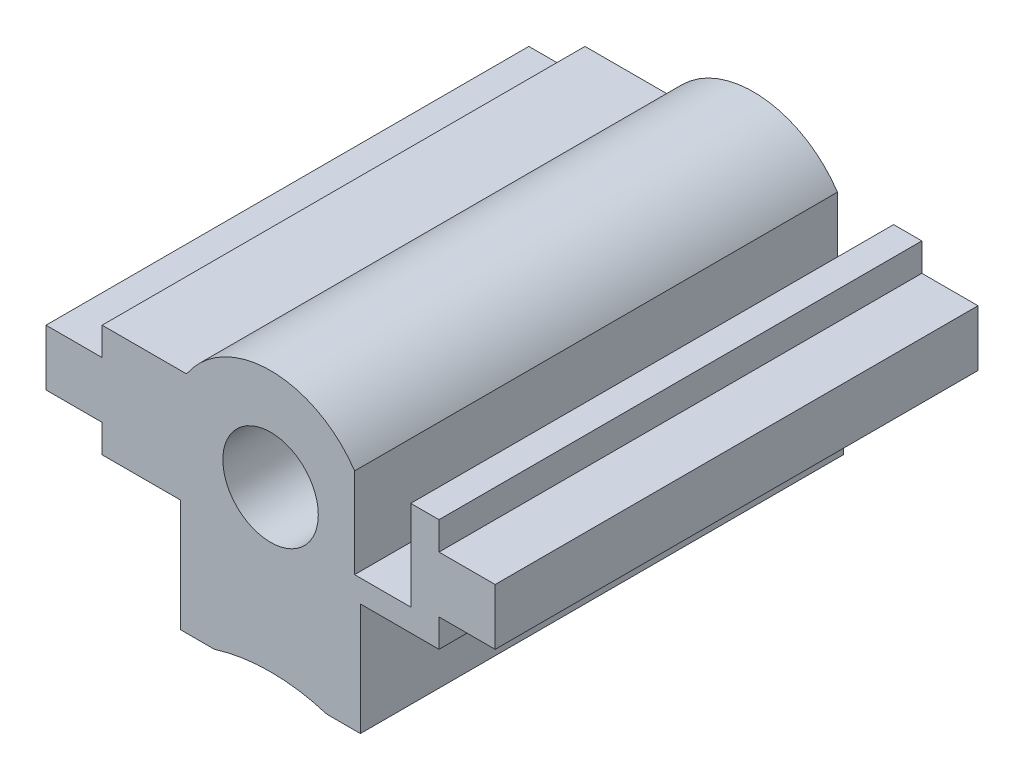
SolidWorks part; units mm, degrees
ref_plane "Front Plane" through (0, 0, 0) normal (0, 0, 1) x (1, 0, 0)
ref_plane "Top Plane" through (0, 0, 0) normal (0, 1, 0) x (1, 0, 0)
ref_plane "Right Plane" through (0, 0, 0) normal (1, 0, 0) x (0, 0, -1)
sketch "Sketch2" plane through (0, 0, 0) normal (0, 0, 1) x (1, 0, 0)
  line L0 (-31.3572, 0) -> (29.773, 0) construction
  line L1 (0, 22.7798) -> (0, -25.7754) construction
  line L2 (15, 2.5) -> (20, 2.5)
  line L3 (-20, -2.5) -> (-15, -2.5)
  line L4 (-20, -2.5) -> (-20, 2.5)
  line L5 (-20, 2.5) -> (-15, 2.5)
  line L6 (20, -2.5) -> (20, 2.5)
  line L7 (-20, -2.5) -> (20, 2.5) construction
  line L8 (-20, 2.5) -> (20, -2.5) construction
  line L9 (-15, -5) -> (-8, -5)
  line L10 (-15, -5) -> (-15, -2.5)
  line L11 (-15, 5) -> (15, 5)
  line L12 (15, -5) -> (15, -2.5)
  line L13 (-15, -5) -> (15, 5) construction
  line L14 (-15, 5) -> (15, -5) construction
  line L15 (-15, 2.5) -> (-15, 5)
  line L16 (15, -2.5) -> (20, -2.5)
  line L17 (15, 2.5) -> (15, 5)
  line L18 (-8, -5) -> (-8, -15)
  line L19 (-8, -15) -> (-5, -15)
  line L20 (-5, -15) -> (-5, -12)
  line L21 (-5, -12) -> (-2, -12)
  line L22 (-2, -12) -> (-2, -8)
  line L23 (-2, -8) -> (-5, -8)
  line L24 (-5, -8) -> (-5, -5)
  line L25 (-5, -5) -> (5, -5)
  line L26 (2, -8) -> (5, -8)
  line L27 (2, -12) -> (2, -8)
  line L28 (5, -12) -> (2, -12)
  line L29 (5, -15) -> (5, -12)
  line L30 (8, -15) -> (5, -15)
  line L31 (8, -5) -> (8, -15)
  line L32 (5, -8) -> (5, -5)
  line L33 (8, -5) -> (15, -5)
  point P5 (0, 0)
  point P10 (0, 0)
  dimension "D1" = 5
  dimension "D2" = 40
  dimension "D3" = 30
  dimension "D4" = 10
  dimension "D5" = 5
  dimension "D6" = 3
  dimension "D7" = 3
  dimension "D8" = 4
  dimension "D9" = 3
extrude "Boss-Extrude2" add sketch "Sketch2" along normal blind 43
sketch "Sketch3" plane through (0, 0, 43) normal (0, 0, 1) x (1, 0, 0)
  line L0 (0, 0) -> (0, -30.9129) construction
  line L1 (-8, -5) -> (8, -5)
  line L2 (-8, -5) -> (-8, -15)
  line L3 (8, -15) -> (5, -15)
  line L4 (8, -5) -> (8, -15)
  line L5 (-8, -15) -> (-5, -15)
  arc A0 (5, -15) -> (-5, -15) centre (0, -30.9863) ccw
  dimension "D1" = 33.5
extrude "Boss-Extrude3" add sketch "Sketch3" against normal blind 3
sketch "Sketch4" plane through (0, 0, 0) normal (0, 0, -1) x (-1, 0, 0)
  line L1 (-5, -8) -> (5, -8)
  line L2 (-5, -8) -> (-5, -12)
  line L3 (-5, -12) -> (5, -12)
  line L4 (5, -8) -> (5, -12)
extrude "Cut-Extrude1" cut sketch "Sketch4" against normal blind 3
sketch "Sketch6" plane through (0, 0, 0) normal (0, 0, 1) x (1, 0, 0)
  line L0 (-7.4833, 5) -> (7.4833, 5)
  line L1 (15, 5) -> (-15, 5) construction
  arc A0 (7.4833, 5) -> (-7.4833, 5) centre (0, 0) ccw
  dimension "D1" = 9
extrude "Boss-Extrude4" add sketch "Sketch6" along normal up to surface (43 mm away)
sketch "Sketch7" plane through (0, 0, 43) normal (0, 0, 1) x (1, 0, 0)
  circle A0 centre (0, 0) radius 4.25
  dimension "D1" = 8.5
extrude "Cut-Extrude3" cut sketch "Sketch7" against normal up to next
sketch "Sketch9" plane through (0, 0, 43) normal (0, 0, 1) x (1, 0, 0)
  line L0 (15, 5) -> (7.4833, 5) construction
  line L1 (7.4833, 5) -> (12.4833, 5)
  line L2 (7.4833, 5) -> (7.4833, -3)
  line L3 (7.4833, -3) -> (12.4833, -3)
  line L4 (12.4833, 5) -> (12.4833, -3)
  dimension "D1" = 8
  dimension "D2" = 5
extrude "Cut-Extrude4" cut sketch "Sketch9" against normal up to next
